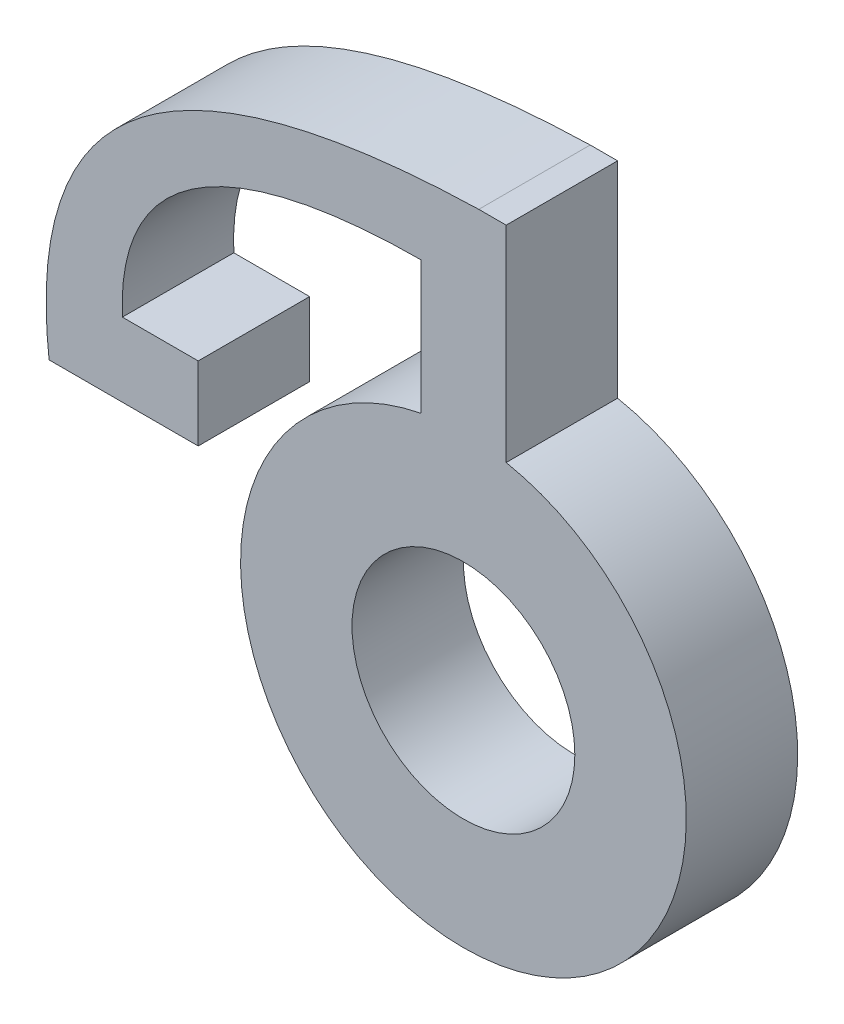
SolidWorks part; units mm, degrees
ref_plane "Front Plane" through (0, 0, 0) normal (0, 0, 1) x (1, 0, 0)
ref_plane "Top Plane" through (0, 0, 0) normal (0, 1, 0) x (1, 0, 0)
ref_plane "Right Plane" through (0, 0, 0) normal (1, 0, 0) x (0, 0, -1)
sketch "Sketch1" plane through (0, 0, 0) normal (0, 0, 1) x (1, 0, 0)
  line L0 (-11.8054, 2.2525) -> (-7.557, 2.2525)
  line L1 (0.4379, 12.0905) -> (1.2181, 12.0905)
  line L2 (-1.2125, 10.0205) -> (-1.2125, 6.2332)
  line L4 (1.2181, 12.0905) -> (1.2181, 6.2321)
  line L5 (-1.2494, 15.3116) -> (0.2889, 9.985) construction
  line L6 (-1.3826, 6.1977) -> (1.2181, 12.0905) construction
  line L7 (-7.557, 2.2525) -> (-7.557, 4.3524)
  line L8 (-7.557, 4.3524) -> (-9.7183, 4.3524)
  circle A0 centre (0, 0) radius 3.175
  arc A1 (-1.2125, 6.2332) -> (1.2181, 6.2321) centre (0, 0) ccw
  spline S0 degree 2 poles (0.4379, 12.0905) (-12.9098, 11.7387) (-11.8054, 2.2525) knots 0 0 0 1 1 1
  spline S1 degree 3 poles (-9.7183, 4.3524) (-9.9274, 9.2319) (-4.6605, 10.0074) (-1.2125, 10.0205) knots 0 0 0 0 0.593317 0.593317 0.593317 0.593317
  point P4 (0.2889, 9.985)
extrude "Boss-Extrude1" add sketch "Sketch1" along normal blind 3.175
